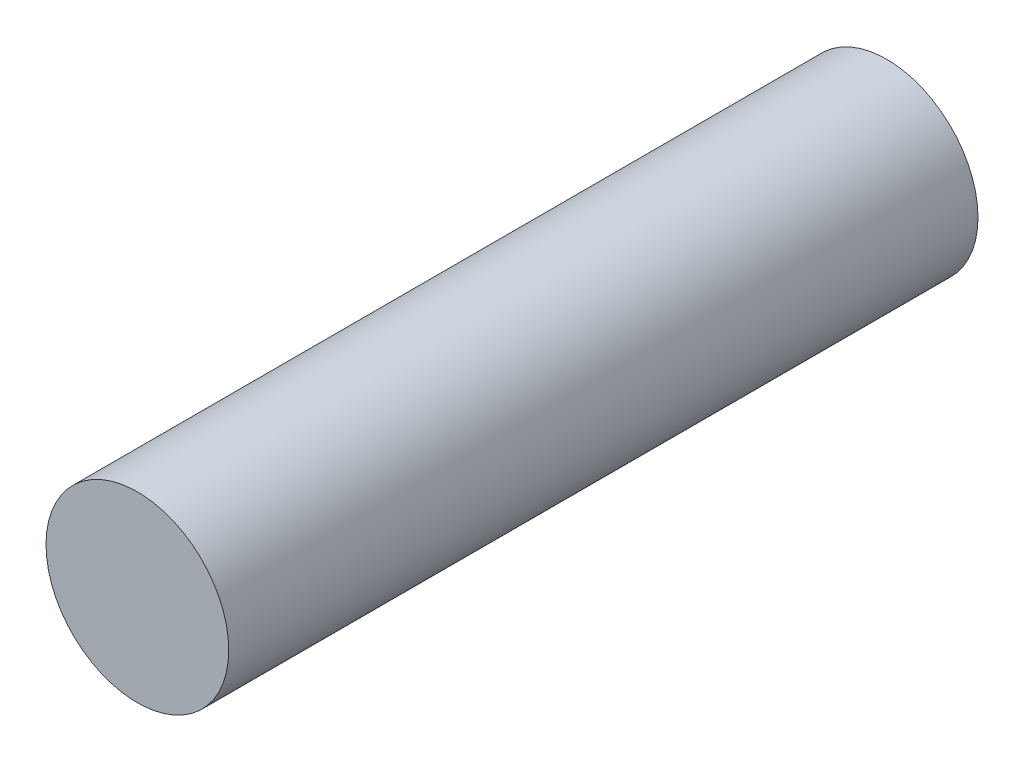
SolidWorks part; units mm, degrees
ref_plane "Plan1" through (0, 0, 0) normal (0, 0, 1) x (1, 0, 0)
ref_plane "Plan2" through (0, 0, 0) normal (0, 1, 0) x (1, 0, 0)
ref_plane "Plan3" through (0, 0, 0) normal (1, 0, 0) x (0, 0, -1)
sketch "Esquisse1" plane through (0, 0, 0) normal (0, 0, 1) x (1, 0, 0)
  circle A0 centre (0, 0) radius 9.39
  dimension "D1" = 18.78
extrude "Base-Extrusion" add sketch "Esquisse1" along normal blind 77
hole_wizard "Trou taraudé M10x1.51" positions "Esquisse3" profile "Esquisse2" tap size "M10x1.5" standard "ISO"
sketch "Esquisse3" plane through (0, 0, 0) normal (0, 0, -1) x (-1, 0, 0)
  point P0 (0, 0)
sketch "Esquisse2" plane through (0, 0, 0) normal (1, 0, 0) x (0, 1, 0)
  line L0 (0, 0) -> (0, 53.3094)
  line L1 (0, 53.3094) -> (4, 51)
  line L2 (4, 51) -> (4, 0)
  line L5 (4, 0) -> (0, 0)
  line L10 (0, 53.3094) -> (-4, 51) construction
  line L11 (0, -6.35) -> (0, 107.95) construction
  dimension "Diamètre du perçage" = 8
  dimension "Profondeur du perçage" = 51
  dimension "Angle de pointe" = 120
